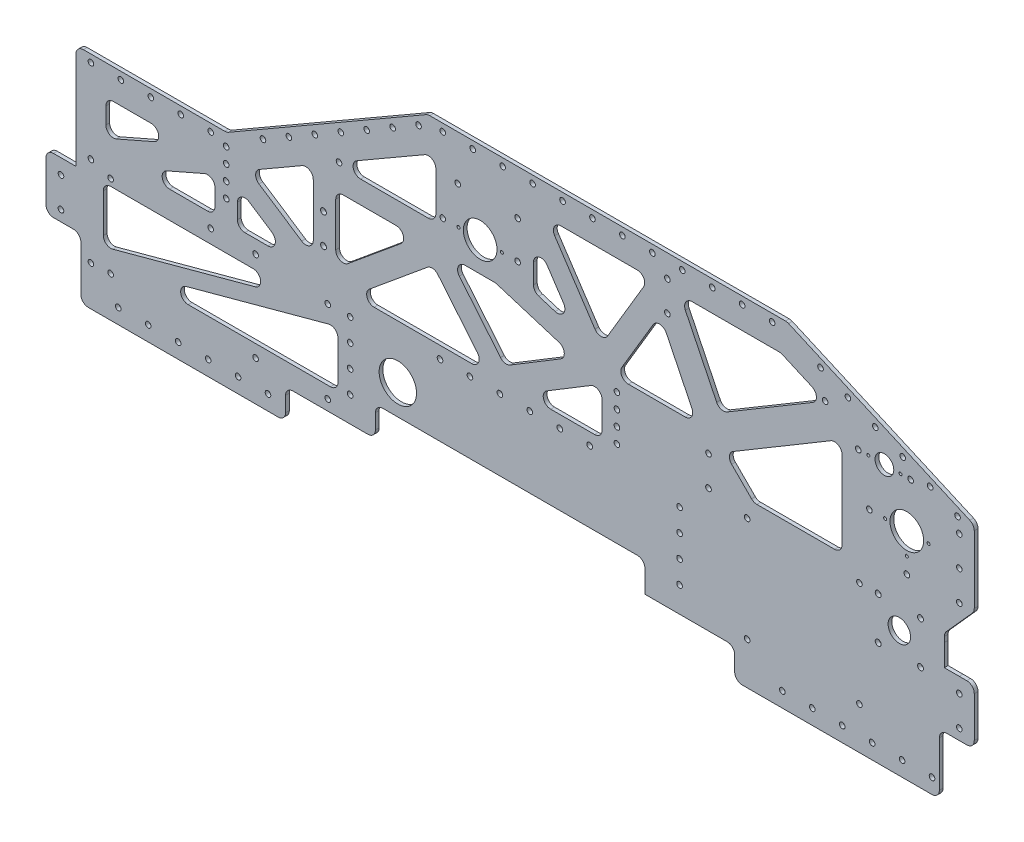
SolidWorks part; units mm, degrees
ref_plane "Front Plane" through (0, 0, 0) normal (0, 0, 1) x (1, 0, 0)
ref_plane "Top Plane" through (0, 0, 0) normal (0, 1, 0) x (1, 0, 0)
ref_plane "Right Plane" through (0, 0, 0) normal (1, 0, 0) x (0, 0, -1)
sketch "Sketch1" plane through (0, 0, 0) normal (0, 0, 1) x (1, 0, 0)
  line L0 (787.4, -148.803) -> (787.4, -101.6)
  line L1 (628.65, 85.725) -> (323.85, 85.725)
  line L2 (787.4, 15.875) -> (628.65, 85.725)
  line L3 (787.4, -101.6) -> (762, -101.6)
  line L4 (762, -101.6) -> (762, -76.2)
  line L5 (787.4, 15.875) -> (787.4, -73.025)
  line L6 (0, -101.6) -> (0, -148.803)
  line L7 (762, -76.2) -> (784.225, -76.2)
  line L8 (787.4, -148.803) -> (757.8269, -200.025)
  line L9 (29.5731, -200.025) -> (203.2, -200.025)
  line L10 (25.4, -76.2) -> (0, -76.2)
  line L11 (25.4, -101.6) -> (25.4, -76.2)
  line L12 (0, -148.803) -> (29.5731, -200.025)
  line L14 (757.8269, -200.025) -> (584.2, -200.025)
  line L16 (584.2, -200.025) -> (584.2, -174.625)
  line L17 (279.4, -149.225) -> (508, -149.225)
  line L19 (203.2, -174.625) -> (203.2, -200.025)
  line L20 (203.2, -174.625) -> (279.4, -174.625)
  line L22 (584.2, -174.625) -> (508, -174.625)
  line L23 (279.4, -149.225) -> (279.4, -174.625)
  line L24 (508, -174.625) -> (508, -149.225)
  line L25 (0, -101.6) -> (25.4, -101.6)
  line L26 (0, 0) -> (323.85, 85.725)
  line L27 (0, -76.2) -> (0, 0)
  arc A0 (787.4, -73.025) -> (784.225, -76.2) centre (784.225, -73.025) cw
  point P15 (787.4, -101.6)
  point P33 (29.5731, -200.025)
  point P36 (0, -148.803)
  point P39 (787.4, -148.803)
  point P42 (757.8269, -200.025)
  point P45 (584.2, -200.025)
  point P48 (508, -149.225)
  point P51 (279.4, -149.225)
  point P54 (203.2, -200.025)
  point P57 (0, -101.6)
  dimension "D9" = 3.175
  dimension "D26" = 285.75
  dimension "D4" = 25.4
  dimension "D5" = 150
  dimension "D7" = 25.4
  dimension "D8" = 150
  dimension "D10" = 158.75
  dimension "D12" = 98.425
  dimension "D14" = 25.4
  dimension "D15" = 25.4
  dimension "D16" = 59.1461
  dimension "D17" = 728.2539
  dimension "D20" = 76.2
  dimension "D21" = 173.6269
  dimension "D22" = 200.025
  dimension "D23" = 203.2
  dimension "D24" = 50.8
  dimension "D25" = 381
  dimension "D27" = 304.8
  dimension "D28" = 215.9
  dimension "D30" = 177.8
base flange "Base-Flange1" sketch "Sketch1" thickness 3.175 reverse thickness direction no parameters "D1"=7
sketch "Sketch98" plane through (0, 0, 0) normal (0, 0, 1) x (1, 0, 0)
  line L0 (787.4, -73.025) -> (787.4, 15.875) construction
  line L1 (730.1992, -17.145) -> (723.8492, -93.345) construction
  line L2 (730.1992, -17.145) -> (748.6269, -17.145) construction
  line L3 (730.1992, -17.145) -> (711.7715, -17.145) construction
  line L4 (730.1992, -17.145) -> (730.1992, -35.5727) construction
  line L5 (730.1992, -35.5727) -> (730.1992, -48.895) construction
  line L6 (711.7715, -17.145) -> (698.4492, -17.145) construction
  line L8 (741.8097, -111.3055) -> (705.8887, -111.3055) construction
  line L9 (741.8097, -111.3055) -> (741.8097, -75.3845) construction
  line L10 (741.8097, -75.3845) -> (705.8887, -75.3845) construction
  line L11 (705.8887, -111.3055) -> (705.8887, -75.3845) construction
  line L12 (741.8097, -111.3055) -> (705.8887, -75.3845) construction
  line L13 (741.8097, -75.3845) -> (705.8887, -111.3055) construction
  line L14 (584.2, -200.025) -> (757.8269, -200.025) construction
  circle A0 centre (730.1992, -17.145) radius 14.2875
  circle A1 centre (711.7715, -17.145) radius 1.27
  circle A2 centre (748.6269, -17.145) radius 1.27
  circle A3 centre (730.1992, -35.5727) radius 1.27
  circle A4 centre (698.4492, -17.145) radius 2.3812
  circle A5 centre (730.1992, -48.895) radius 2.3812
  circle A6 centre (730.1992, -17.145) radius 27.94 construction
  circle A8 centre (723.8492, -93.345) radius 9.525
  circle A9 centre (705.8887, -75.3845) radius 2.4892
  circle A10 centre (705.8887, -111.3055) radius 2.4892
  circle A11 centre (741.8097, -111.3055) radius 2.4892
  circle A12 centre (741.8097, -75.3845) radius 2.4892
  dimension "D1" = 28.575
  dimension "D6" = 2.54
  dimension "D7" = 4.7625
  dimension "D8" = 55.88
  dimension "D9" = 6.35
  dimension "D10" = 4.9784
  dimension "D12" = 19.05
  dimension "D2" = 57.2008
  dimension "D3" = 182.88
  dimension "D4" = 18.4277
  dimension "D5" = 31.75
  dimension "D11" = 50.8
  dimension "D13" = 76.2
extrude "Intakehole" cut sketch "Sketch98" against normal blind 19.05
sketch "Sketch104" plane through (0, 0, 0) normal (0, 0, 1) x (1, 0, 0)
  line L0 (605.79, -36.195) -> (624.2177, -36.195) construction
  line L1 (605.79, -36.195) -> (587.3623, -36.195) construction
  line L2 (787.4, -73.025) -> (787.4, 15.875) construction
  line L3 (688.975, 22.225) -> (697.5348, 22.225) construction
  line L4 (587.3623, -36.195) -> (574.04, -36.195) construction
  line L5 (624.2177, -36.195) -> (637.54, -36.195) construction
  line L6 (368.3, 15.875) -> (386.7277, 15.875) construction
  line L7 (386.7277, 15.875) -> (400.05, 15.875) construction
  line L8 (368.3, 15.875) -> (349.8723, 15.875) construction
  line L9 (349.8723, 15.875) -> (336.55, 15.875) construction
  line L10 (279.4, -149.225) -> (508, -149.225) construction
  line L12 (697.5348, 22.225) -> (711.2, 22.225) construction
  line L13 (724.8652, 22.225) -> (733.425, 22.225) construction
  line L14 (711.2, 22.225) -> (724.8652, 22.225) construction
  line L15 (628.65, 85.725) -> (323.85, 85.725) construction
  line L16 (584.2, -200.025) -> (757.8269, -200.025) construction
  circle A0 centre (605.79, -36.195) radius 14.2875 construction
  circle A1 centre (587.3623, -36.195) radius 1.27 construction
  circle A2 centre (624.2177, -36.195) radius 1.27 construction
  circle A3 centre (368.3, 15.875) radius 14.2875
  circle A4 centre (386.7277, 15.875) radius 1.27
  circle A5 centre (349.8723, 15.875) radius 1.27
  circle A6 centre (400.05, 15.875) radius 2.3813
  circle A7 centre (336.55, 15.875) radius 2.3813
  circle A8 centre (637.54, -36.195) radius 2.3812 construction
  circle A9 centre (574.04, -36.195) radius 2.3812 construction
  circle A10 centre (711.2, 22.225) radius 7.9375
  circle A11 centre (697.5348, 22.225) radius 1.27
  circle A12 centre (724.8652, 22.225) radius 1.27
  circle A13 centre (733.425, 22.225) radius 2.3812
  circle A14 centre (688.975, 22.225) radius 2.3812
  circle A15 centre (711.2, 22.225) radius 11.1125 construction
  circle A16 centre (724.8652, 22.225) radius 2.5527 construction
  dimension "D3" = 28.575
  dimension "D6" = 2.54
  dimension "D7" = 4.7625
  dimension "D12" = 15.875
  dimension "D14" = 5.1054
  dimension "D15" = 22.225
  dimension "D1" = 181.61
  dimension "D2" = 163.83
  dimension "D4" = 419.1
  dimension "D5" = 165.1
  dimension "D8" = 18.4277
  dimension "D9" = 31.75
  dimension "D10" = 76.2
  dimension "D11" = 63.5
  dimension "D13" = 22.225
extrude "PlateBearingHoles" cut sketch "Sketch104" against normal through all
sketch "Sketch107" plane through (0, 0, 0) normal (0, 0, 1) x (1, 0, 0)
  line L0 (0, 0) -> (0, -76.2) construction
  line L1 (0, -76.2) -> (25.4, -76.2) construction
  circle A0 centre (152.8481, -48.7743) radius 2.3813
  circle A1 centre (152.8481, -48.7743) radius 2.3813 construction
  circle A2 centre (152.8481, -61.4743) radius 2.3813
  circle A3 centre (152.8481, -61.4743) radius 2.3813 construction
  circle A4 centre (152.8481, -23.3743) radius 2.3813
  circle A6 centre (152.8481, -36.0743) radius 2.3813
  circle A8 centre (152.8481, -36.0743) radius 2.3813 construction
  circle A9 centre (152.8481, -23.3743) radius 2.3813 construction
  circle A10 centre (235.3981, -29.7243) radius 2.4892
  circle A11 centre (235.3981, -55.1243) radius 2.4892
  circle A12 centre (235.3981, -55.1243) radius 2.4892 construction
  circle A13 centre (235.3981, -29.7243) radius 2.4892 construction
  dimension "D1" = 25.4
  dimension "D2" = 6.35
  dimension "D3" = 82.55
  dimension "D4" = 12.7
  dimension "D5" = 12.7
  dimension "D6" = 12.7
  dimension "D7" = 152.8481
  dimension "D8" = 52.8257
extrude "Cut-Extrude23" cut sketch "Sketch107" against normal blind 3.175
sketch "Sketch108" plane through (0, 0, 0) normal (0, 0, 1) x (1, 0, 0)
  line L0 (584.2, -200.025) -> (757.8269, -200.025) construction
  line L1 (-9.937, -148.803) -> (29.5731, -148.803)
  line L2 (29.5731, -148.803) -> (29.5731, -225.003)
  line L3 (29.5731, -225.003) -> (-9.937, -225.003)
  line L4 (-9.937, -148.803) -> (-9.937, -225.003)
  line L5 (757.8269, -148.803) -> (757.8269, -214.0682)
  line L7 (852.5414, -214.0682) -> (757.8269, -214.0682)
  line L8 (852.5414, -214.0682) -> (852.5414, -148.803)
  line L9 (757.8269, -148.803) -> (852.5414, -148.803)
  line L12 (762, -88.9) -> (762, -76.2)
  line L13 (762, -101.6) -> (762, -76.2) construction
  line L14 (762, -76.2) -> (787.4, -47.8019)
  line L15 (787.4, -73.025) -> (787.4, 15.875) construction
  line L16 (787.4, -47.8019) -> (787.4, -88.9)
  line L17 (787.4, -88.9) -> (762, -88.9)
  line L18 (25.4, -88.9) -> (25.4, -76.2)
  line L19 (25.4, -76.2) -> (25.4, -101.6) construction
  line L20 (25.4, -76.2) -> (0, -47.8019)
  line L21 (0, 0) -> (0, -76.2) construction
  line L22 (0, -47.8019) -> (0, -88.9)
  line L23 (0, -88.9) -> (25.4, -88.9)
  dimension "D1" = 38.1
  dimension "D2" = 76.2
extrude "Cut-Extrude27" cut sketch "Sketch108" against normal blind 2.54
fillet "Fillet2" radius 6.35 7 edges at (0, 0, -1.5875) (29.5731, -148.803, -1.5875) (757.8269, -148.803, -1.5875) (762, -76.2, -1.5875) (787.4, -47.8019, -1.5875) (25.4, -76.2, -1.5875) (0, -47.8019, -1.5875)
sketch "Sketch109" plane through (0, 0, -3.175) normal (0, 0, -1) x (-1, 0, 0)
  line L0 (-25.4, -78.6255) -> (-25.4, -101.6) construction
  line L1 (-25.4, -89.8994) -> (28.273, -89.8994)
  line L2 (-25.4, -89.8994) -> (-25.4, 36.3327)
  line L3 (-25.4, 36.3327) -> (28.273, 36.3327)
  line L4 (28.273, -89.8994) -> (28.273, 36.3327)
  line L5 (-323.85, 85.725) -> (-25.4, 6.7235)
  line L6 (-323.85, 85.725) -> (-4.7251, 1.2508) construction
  line L7 (-323.85, 85.725) -> (-153.3729, -12.7)
  line L8 (-153.3729, -12.7) -> (-25.4, -12.7)
  line L9 (-25.4, -101.6) -> (0, -101.6) construction
  line L10 (-628.65, 85.725) -> (-323.85, 85.725) construction
  dimension "D1" = 88.9
  dimension "D2" = 150
extrude "Cuts" cut sketch "Sketch109" against normal through all
sketch "Sketch110" plane through (0, 0, -3.175) normal (0, 0, -1) x (-1, 0, 0)
  line L0 (-787.4, -45.3765) -> (-787.4, 15.875) construction
  line L3 (-574.6608, -82.423) -> (-473.0608, -82.423) construction
  line L4 (-574.6608, -82.423) -> (-574.6608, -31.623) construction
  line L5 (-574.6608, -31.623) -> (-473.0608, -31.623) construction
  line L6 (-473.0608, -82.423) -> (-473.0608, -31.623) construction
  circle A0 centre (-484.3028, -76.073) radius 2.3812
  circle A1 centre (-484.3028, -63.373) radius 2.3812
  circle A2 centre (-484.3028, -50.673) radius 2.3812
  circle A3 centre (-484.3028, -37.973) radius 2.3812
  circle A4 centre (-549.2608, -57.023) radius 3.9687 construction
  circle A5 centre (-561.9608, -44.323) radius 2.3812
  circle A6 centre (-561.9608, -69.723) radius 2.3812
  circle A7 centre (-730.1992, -17.145) radius 14.2875 construction
  dimension "D1" = 4.7625
  dimension "D5" = 7.9375
  dimension "D2" = 12.7
  dimension "D3" = 12.7
  dimension "D4" = 12.7
  dimension "D6" = 238.1392
  dimension "D7" = 39.878
  dimension "D8" = 11.242
  dimension "D9" = 6.35
  dimension "D10" = 101.6
  dimension "D11" = 50.8
  dimension "D12" = 25.4
  dimension "D13" = 25.4
  dimension "D14" = 12.7
  dimension "D15" = 12.7
  dimension "D16" = 12.7
extrude "Cut-Extrude29" cut sketch "Sketch110" against normal through all
sketch "Sketch111" plane through (0, 0, 0) normal (0, 0, 1) x (1, 0, 0)
  line L0 (29.5731, -200.025) -> (203.2, -200.025) construction
  line L1 (29.5731, -155.153) -> (29.5731, -200.025) construction
  line L2 (584.2, -174.625) -> (584.2, -200.025) construction
  line L3 (584.2, -200.025) -> (757.8269, -200.025) construction
  line L4 (25.4, -101.6) -> (0, -101.6) construction
  line L5 (0, -101.6) -> (0, -148.803) construction
  line L7 (787.4, -101.6) -> (762, -101.6) construction
  line L8 (787.4, -148.803) -> (787.4, -101.6) construction
  circle A0 centre (61.3231, -187.325) radius 2.3813
  circle A1 centre (86.7231, -187.325) radius 2.3812
  circle A2 centre (112.1231, -187.325) radius 2.3813
  circle A3 centre (137.5231, -187.325) radius 2.3813
  circle A4 centre (162.9231, -187.325) radius 2.3813
  circle A5 centre (188.3231, -187.325) radius 2.3812
  circle A6 centre (624.586, -187.325) radius 2.3812
  circle A7 centre (649.986, -187.325) radius 2.3812
  circle A8 centre (675.386, -187.325) radius 2.3812
  circle A9 centre (700.786, -187.325) radius 2.3812
  circle A10 centre (726.186, -187.325) radius 2.3812
  circle A11 centre (751.586, -187.325) radius 2.3812
  circle A12 centre (12.7, -114.3) radius 2.3812
  circle A13 centre (12.7, -139.7) radius 2.3812
  circle A14 centre (774.7, -114.3) radius 2.3812
  circle A15 centre (774.7, -139.7) radius 2.3812
  dimension "D1" = 4.7625
  dimension "D6" = 4.7625
  dimension "D11" = 4.7625
  dimension "D15" = 4.7625
  dimension "D2" = 12.7
  dimension "D3" = 31.75
  dimension "D5" = 25.4
  dimension "D7" = 40.386
  dimension "D8" = 12.7
  dimension "D10" = 25.4
  dimension "D12" = 12.7
  dimension "D13" = 12.7
  dimension "D14" = 25.4
  dimension "D16" = 12.7
  dimension "D17" = 12.7
  dimension "D18" = 25.4
  dimension "D4" = 6
  dimension "D9" = 6
extrude "Cut-Extrude30" cut sketch "Sketch111" against normal blind 3.175
sketch "Sketch113" plane through (0, 0, -3.175) normal (0, 0, -1) x (-1, 0, 0)
  circle A0 centre (-258.019, -153.02) radius 2.3813 construction
  circle A1 centre (-258.019, -133.97) radius 2.3813 construction
  circle A2 centre (-258.019, -114.92) radius 2.3813 construction
  circle A3 centre (-258.019, -95.87) radius 2.3812 construction
  circle A4 centre (-537.419, -95.87) radius 2.3813 construction
  circle A5 centre (-537.419, -114.92) radius 2.3813 construction
  circle A6 centre (-537.419, -133.97) radius 2.3813 construction
  circle A7 centre (-537.419, -153.02) radius 2.3813 construction
  circle A8 centre (-258.019, -153.02) radius 2.3813
  circle A9 centre (-258.019, -133.97) radius 2.3813
  circle A10 centre (-258.019, -114.92) radius 2.3813
  circle A11 centre (-258.019, -95.87) radius 2.3812
  circle A12 centre (-537.419, -95.87) radius 2.3812
  circle A13 centre (-537.419, -114.92) radius 2.3812
  circle A14 centre (-537.419, -133.97) radius 2.3812
  circle A15 centre (-537.419, -153.02) radius 2.3812
extrude "Cut-Extrude31" cut sketch "Sketch113" against normal through all
sketch "Sketch114" plane through (0, 0, 0) normal (0, 0, 1) x (1, 0, 0)
  line L0 (279.4, -149.225) -> (508, -149.225) construction
  line L1 (279.4, -107.0245) -> (315.2505, -107.0245) construction
  line L2 (279.4, -107.0245) -> (279.4, -142.875) construction
  line L3 (279.4, -142.875) -> (315.2505, -142.875) construction
  line L4 (315.2505, -107.0245) -> (315.2505, -142.875) construction
  line L5 (279.4, -174.625) -> (279.4, -149.225) construction
  line L6 (279.4, -174.625) -> (279.4, -149.225) construction
  circle A0 centre (298.45, -123.825) radius 25.4 construction
  circle A1 centre (298.45, -123.825) radius 15.875
  circle A2 centre (279.4, -107.0245) radius 2.4892 construction
  circle A3 centre (315.2505, -107.0245) radius 2.4892 construction
  circle A4 centre (315.2505, -142.875) radius 2.4892 construction
  circle A5 centre (279.4, -142.875) radius 2.4892 construction
  dimension "D1" = 50.8
  dimension "D2" = 31.75
  dimension "D3" = 4.9784
  dimension "D4" = 25.4
  dimension "D5" = 19.05
extrude "VersaplanetaryMount" cut sketch "Sketch114" against normal through all
fillet "Fillet3" radius 6.35 20 edges at (762, -101.6, -1.5875) (787.4, -101.6, -1.5875) (787.4, -148.803, -1.5875) (757.8269, -200.025, -1.5875) (584.2, -200.025, -1.5875) (203.2, -200.025, -1.5875) (29.5731, -200.025, -1.5875) (0, -148.803, -1.5875) (0, -101.6, -1.5875) (25.4, -101.6, -1.5875) (787.4, 15.875, -1.5875) (628.65, 85.725, -1.5875) (584.2, -174.625, -1.5875) (508, -149.225, -1.5875) (279.4, -149.225, -1.5875) (279.4, -174.625, -1.5875) (203.2, -174.625, -1.5875) (323.85, 85.725, -1.5875) (153.3729, -12.7, -1.5875) (25.4, -12.7, -1.5875)
sketch "Sketch115" plane through (0, 0, 0) normal (0, 0, 1) x (1, 0, 0)
  line L0 (25.4, -89.8994) -> (25.4, -95.25) construction
  line L2 (23.2231, -148.803) -> (6.35, -148.803) construction
  circle A0 centre (38.1, -90.0099) radius 2.3812
  circle A1 centre (139.7, -90.0099) radius 2.3813
  circle A2 centre (177.8, -90.0099) radius 2.3813
  circle A3 centre (177.8, -166.2099) radius 2.3813
  circle A4 centre (38.1, -166.2099) radius 2.3812
  dimension "D2" = 4.7625
  dimension "D5" = 17.4069
  dimension "D1" = 12.7
  dimension "D3" = 101.6
  dimension "D4" = 139.7
  dimension "D6" = 76.2
extrude "Cut-Extrude32" cut sketch "Sketch115" against normal blind 3.175
sketch "Sketch116" plane through (0, 0, -3.175) normal (0, 0, -1) x (-1, 0, 0)
  line L0 (-385.019, -88.885) -> (-410.419, -88.885) construction
  line L1 (-485.984, -90.17) -> (-423.754, -90.17) construction
  line L2 (-485.984, -90.17) -> (-485.984, -132.08) construction
  line L3 (-485.984, -132.08) -> (-423.754, -132.08) construction
  line L4 (-423.754, -90.17) -> (-423.754, -132.08) construction
  line L5 (-485.984, -90.17) -> (-423.754, -132.08) construction
  line L6 (-485.984, -132.08) -> (-423.754, -90.17) construction
  line L7 (-393.909, -90.17) -> (-331.679, -90.17) construction
  line L8 (-393.909, -90.17) -> (-393.909, -132.08) construction
  line L9 (-393.909, -132.08) -> (-331.679, -132.08) construction
  line L10 (-331.679, -90.17) -> (-331.679, -132.08) construction
  line L11 (-393.909, -90.17) -> (-331.679, -132.08) construction
  line L12 (-393.909, -132.08) -> (-331.679, -90.17) construction
  line L13 (-397.719, -88.885) -> (-397.719, -149.225) construction
  line L18 (-285.75, -149.225) -> (-501.65, -149.225) construction
  circle A0 centre (-334.219, -88.885) radius 2.3813
  circle A1 centre (-258.019, -95.87) radius 2.3812 construction
  circle A2 centre (-359.619, -88.885) radius 2.3813
  circle A3 centre (-385.019, -88.885) radius 2.3813
  circle A4 centre (-410.419, -88.885) radius 2.3813
  circle A5 centre (-435.819, -88.885) radius 2.3813
  circle A6 centre (-461.219, -88.885) radius 2.3813
  point P5 (-454.869, -111.125)
  point P19 (-362.794, -111.125)
  dimension "D3" = 4.7625
  dimension "D1" = 76.2
  dimension "D2" = 6.985
  dimension "D5" = 25.4
  dimension "D6" = 62.23
  dimension "D7" = 41.91
  dimension "D8" = 57.15
  dimension "D9" = 38.1
  dimension "D11" = 34.925
  dimension "D4" = 6
extrude "Cut-Extrude33" cut sketch "Sketch116" against normal blind 3.175
sketch "Sketch118" plane through (0, 0, -3.175) normal (0, 0, -1) x (-1, 0, 0)
  line L1 (-690.0137, -75.3845) -> (-594.7637, -75.3845) construction
  line L2 (-690.0137, -75.3845) -> (-690.0137, -164.2845) construction
  line L3 (-690.0137, -164.2845) -> (-594.7637, -164.2845) construction
  line L4 (-594.7637, -75.3845) -> (-594.7637, -164.2845) construction
  line L5 (-690.0137, -75.3845) -> (-594.7637, -164.2845) construction
  line L6 (-690.0137, -164.2845) -> (-594.7637, -75.3845) construction
  circle A0 centre (-690.0137, -75.3845) radius 2.3812
  circle A1 centre (-594.7637, -75.3845) radius 2.3812
  circle A2 centre (-594.7637, -164.2845) radius 2.3812
  circle A3 centre (-690.0137, -164.2845) radius 2.3812
  point P0 (-642.3887, -119.8345)
  point P5 (-705.8887, -75.3845)
  dimension "D4" = 4.7625
  dimension "D1" = 88.9
  dimension "D2" = 95.25
  dimension "D3" = 63.5
extrude "Cut-Extrude35" cut sketch "Sketch118" against normal blind 3.175
sketch "Sketch120" plane through (0, 0, -3.175) normal (0, 0, -1) x (-1, 0, 0)
  line L1 (-238.969, -95.87) -> (-54.819, -95.87) construction
  line L2 (-238.969, -95.87) -> (-238.969, -165.72) construction
  line L3 (-238.969, -165.72) -> (-54.819, -165.72) construction
  line L4 (-54.819, -95.87) -> (-54.819, -165.72) construction
  circle A0 centre (-238.969, -95.87) radius 2.3813
  circle A1 centre (-238.969, -165.72) radius 2.3813
  circle A2 centre (-54.819, -165.72) radius 2.3812
  circle A3 centre (-54.819, -95.87) radius 2.3812
  point P8 (-258.019, -95.87)
  dimension "D3" = 4.7625
  dimension "D1" = 69.85
  dimension "D2" = 184.15
  dimension "D4" = 19.05
extrude "Cut-Extrude36" cut sketch "Sketch120" against normal blind 3.175
sketch "Sketch126" plane through (0, 0, -3.175) normal (0, 0, -1) x (-1, 0, 0)
  line L1 (-783.6074, 17.5437) -> (-629.8722, 85.1873) construction
  line L2 (-775.7755, 20.9898) -> (-787.4, 15.875) construction
  line L3 (-787.4, 11.7315) -> (-787.4, 15.875) construction
  line L4 (-773.2181, 15.1775) -> (-775.7755, 20.9898) construction
  line L5 (-627.3148, 85.725) -> (-325.5515, 85.725) construction
  line L6 (-615.95, 85.725) -> (-628.65, 85.725) construction
  line L7 (-633.2345, 83.7078) -> (-628.65, 85.725) construction
  line L8 (-325.5515, 85.725) -> (-323.85, 85.725) construction
  line L9 (-312.8515, 79.375) -> (-323.85, 85.725) construction
  line L10 (-322.3765, 84.8743) -> (-154.8464, -11.8493) construction
  line L11 (-312.8515, 79.375) -> (-316.0265, 73.8757) construction
  line L12 (-25.4, -19.05) -> (-25.4, -12.7) construction
  line L13 (-25.4, -12.7) -> (-38.1, -12.7) construction
  line L14 (-151.6714, -12.7) -> (-31.75, -12.7) construction
  circle A0 centre (-773.2181, 15.1775) radius 2.3812
  circle A1 centre (-749.9691, 25.4071) radius 2.3812
  circle A2 centre (-726.7201, 35.6367) radius 2.3812
  circle A3 centre (-703.4711, 45.8662) radius 2.3812
  circle A4 centre (-680.2221, 56.0958) radius 2.3812
  circle A5 centre (-656.9731, 66.3253) radius 2.3812
  circle A6 centre (-615.95, 79.375) radius 2.3812
  circle A8 centre (-590.55, 79.375) radius 2.3812
  circle A9 centre (-565.15, 79.375) radius 2.3812
  circle A10 centre (-539.75, 79.375) radius 2.3812
  circle A11 centre (-514.35, 79.375) radius 2.3812
  circle A12 centre (-488.95, 79.375) radius 2.3812
  circle A13 centre (-463.55, 79.375) radius 2.3812
  circle A14 centre (-438.15, 79.375) radius 2.3812
  circle A15 centre (-412.75, 79.375) radius 2.3812
  circle A16 centre (-387.35, 79.375) radius 2.3812
  circle A17 centre (-361.95, 79.375) radius 2.3812
  circle A18 centre (-336.55, 79.375) radius 2.3812
  circle A19 centre (-316.0265, 73.8757) radius 2.3813
  arc A20 (-322.3765, 84.8743) -> (-325.5515, 85.725) centre (-325.5515, 79.375) ccw construction
  circle A21 centre (-294.0294, 61.1757) radius 2.3813
  circle A22 centre (-272.0324, 48.4757) radius 2.3813
  circle A23 centre (-250.0353, 35.7757) radius 2.3813
  circle A24 centre (-228.0383, 23.0757) radius 2.3813
  circle A25 centre (-206.0413, 10.3757) radius 2.3813
  circle A26 centre (-184.0442, -2.3243) radius 2.3813
  circle A27 centre (-38.1, -19.05) radius 2.3812
  circle A28 centre (-63.5, -19.05) radius 2.3813
  circle A29 centre (-88.9, -19.05) radius 2.3812
  circle A30 centre (-114.3, -19.05) radius 2.3813
  circle A31 centre (-139.7, -19.05) radius 2.3813
  dimension "D2" = 4.7625
  dimension "D1" = 6.35
  dimension "D3" = 12.7
  dimension "D5" = 6.35
  dimension "D6" = 12.7
  dimension "D8" = 12.7
  dimension "D9" = 6.35
  dimension "D11" = 6.35
  dimension "D12" = 12.7
  dimension "D4" = 6
  dimension "D7" = 12
  dimension "D10" = 7
  dimension "D13" = 5
extrude "Cut-Extrude38" cut sketch "Sketch126" against normal blind 3.175
sketch "Sketch131" plane through (0, 0, -3.175) normal (0, 0, -1) x (-1, 0, 0)
  line L0 (-410.667, -18.3632) -> (-468.8619, -36.4096) construction
  line L1 (-226.7095, -78.6255) -> (-226.7095, 9.7844)
  line L2 (-226.7095, 9.7844) -> (-413.4882, 9.7844)
  line L3 (-330.6559, 60.325) -> (-330.6559, 9.7844)
  line L4 (-226.7095, -78.6255) -> (-162.3731, -78.6255)
  line L5 (-162.3731, -78.6255) -> (-162.3731, -36.2421)
  line L6 (-226.7095, -78.6255) -> (-162.3731, -36.2421)
  line L7 (-143.3231, -78.6255) -> (-143.3231, -38.1)
  line L8 (-143.3231, -78.6255) -> (-50.8, -78.6255)
  line L9 (-143.3231, -38.1) -> (-50.8, -78.6255)
  line L10 (-221.4695, -86.5796) -> (-157.1331, -44.1962)
  line L11 (-147.1446, -46.8248) -> (-54.6215, -87.3503)
  line L12 (-231.9495, -70.6714) -> (-167.6131, -28.2879)
  line L13 (-139.5017, -29.3752) -> (-46.9785, -69.9007)
  line L14 (-560.0294, -16.4016) -> (-668.757, 48.3781)
  line L15 (-573.0302, -38.2223) -> (-681.7577, 26.5574)
  line L16 (-535.1628, 65.8961) -> (-577.9426, -21.7408)
  line L17 (-512.3371, 54.7539) -> (-555.117, -32.8831)
  line L52 (-675.2573, 37.4678) -> (-675.2573, -61.1316)
  line L53 (-675.2573, -61.1316) -> (-600.3494, -61.1316)
  line L54 (-600.3494, -61.1316) -> (-566.5298, -27.312)
  line L55 (-566.5298, -27.312) -> (-471.6831, -27.312)
  line L56 (-471.6831, -27.312) -> (-471.6831, -78.6255)
  line L57 (-471.6831, -78.6255) -> (-245.7595, -78.6255)
  line L58 (-245.7595, -78.6255) -> (-245.7595, -9.2656)
  line L59 (-245.7595, -9.2656) -> (-413.4882, -9.2656)
  line L60 (-413.4882, -9.2656) -> (-413.4882, 60.325)
  line L61 (-413.4882, -9.2656) -> (-471.6831, -27.312)
  line L62 (-245.7595, -78.6255) -> (-329.6239, -9.2656)
  line L63 (-329.6239, -9.2656) -> (-386.9878, -78.6255)
  line L64 (-386.9878, -78.6255) -> (-471.6831, -27.312)
  line L65 (-471.6831, -27.312) -> (-413.4882, 60.325)
  line L66 (-471.6831, -27.312) -> (-523.7499, 60.325)
  line L67 (-523.7499, 60.325) -> (-566.5298, -27.312)
  line L68 (-566.5298, -27.312) -> (-675.2573, 37.4678)
  line L69 (-463.4943, -22.4468) -> (-524.5713, 80.3556)
  line L72 (-463.7482, -32.5811) -> (-405.5533, 55.0559)
  line L73 (-412.1284, 1.1285) -> (-474.5043, -18.2143)
  line L74 (-239.689, -71.2855) -> (-330.8933, 4.1448)
  line L75 (-330.8933, 4.1448) -> (-389.0862, -66.2174)
  line L76 (-389.0862, -66.2174) -> (-466.7475, -19.1655)
  line L77 (-479.8719, -32.1771) -> (-522.9286, 40.2944)
  line L78 (-167.5464, -33.8463) -> (-330.6559, 60.325)
  line L79 (-330.6559, 60.325) -> (-623.3091, 60.325)
  line L80 (-623.3091, 60.325) -> (-762, -0.699)
  line L81 (-762, -0.699) -> (-762, -38.1)
  line L82 (-762, -38.1) -> (-744.6849, -57.4588)
  line L83 (-736.6, -78.6255) -> (-736.6, -95.25)
  line L84 (-732.4269, -155.153) -> (-732.4269, -174.625)
  line L85 (-732.4269, -174.625) -> (-608.9585, -174.625)
  line L86 (-577.85, -149.225) -> (-532.7585, -149.225)
  line L87 (-501.65, -123.825) -> (-285.75, -123.825)
  line L88 (-254.6415, -149.225) -> (-209.55, -149.225)
  line L89 (-178.4415, -174.625) -> (-54.9731, -174.625)
  line L90 (-54.9731, -174.625) -> (-54.9731, -155.153)
  line L91 (-50.8, -95.25) -> (-50.8, -89.8994)
  line L92 (-50.8, -89.8994) -> (-50.8, -38.1)
  line L93 (-50.8, -38.1) -> (-151.6714, -38.1)
  line L94 (-167.5464, -33.8463) -> (-330.6559, 60.325)
  line L95 (-330.6559, 60.325) -> (-623.3091, 60.325)
  line L96 (-623.3091, 60.325) -> (-762, -0.699)
  line L97 (-762, -0.699) -> (-762, -38.1)
  line L98 (-762, -38.1) -> (-744.6849, -57.4588)
  line L99 (-736.6, -78.6255) -> (-736.6, -95.25)
  line L100 (-732.4269, -155.153) -> (-732.4269, -174.625)
  line L101 (-732.4269, -174.625) -> (-608.9585, -174.625)
  line L102 (-577.85, -149.225) -> (-532.7585, -149.225)
  line L103 (-501.65, -123.825) -> (-285.75, -123.825)
  line L104 (-254.6415, -149.225) -> (-209.55, -149.225)
  line L105 (-178.4415, -174.625) -> (-54.9731, -174.625)
  line L106 (-54.9731, -174.625) -> (-54.9731, -155.153)
  line L107 (-50.8, -95.25) -> (-50.8, -89.8994)
  line L108 (-50.8, -89.8994) -> (-50.8, -38.1)
  line L109 (-50.8, -38.1) -> (-151.6714, -38.1)
  line L112 (-479.618, -22.0428) -> (-421.423, 65.5941)
  line L113 (-381.3294, -9.2656) -> (-468.8619, -36.4096)
  line L114 (-251.83, -85.9654) -> (-328.3544, -22.6761)
  line L115 (-328.3544, -22.6761) -> (-384.8894, -91.0336)
  line L116 (-384.8894, -91.0336) -> (-476.6187, -35.4584)
  line L117 (-416.3094, -0.168) -> (-474.5043, -18.2143) construction
  line L118 (-570.5481, -13.8304) -> (-670.3821, 45.6505) construction
  line L119 (-562.5115, -40.7935) -> (-680.1326, 29.285) construction
  line L120 (-522.9286, 40.2944) -> (-562.5115, -40.7935) construction
  line L121 (-524.5713, 80.3556) -> (-570.5481, -13.8304) construction
  circle A0 centre (-152.8481, -48.7743) radius 2.3813 construction
  arc A72 (-736.6, -78.6255) -> (-744.6849, -57.4588) centre (-768.35, -78.6255) ccw
  arc A73 (-755.9628, -124.4839) -> (-736.6, -95.25) centre (-768.35, -95.25) ccw
  arc A74 (-732.4269, -155.153) -> (-755.9628, -124.4839) centre (-764.1769, -155.153) ccw
  arc A75 (-577.85, -149.225) -> (-608.9585, -174.625) centre (-577.85, -180.975) ccw
  arc A76 (-501.65, -123.825) -> (-532.7585, -149.225) centre (-501.65, -155.575) ccw
  arc A77 (-254.6415, -149.225) -> (-285.75, -123.825) centre (-285.75, -155.575) ccw
  arc A78 (-178.4415, -174.625) -> (-209.55, -149.225) centre (-209.55, -180.975) ccw
  arc A79 (-31.4372, -124.4839) -> (-54.9731, -155.153) centre (-23.2231, -155.153) ccw
  arc A80 (-50.8, -95.25) -> (-31.4372, -124.4839) centre (-19.05, -95.25) ccw
  arc A81 (-167.5464, -33.8463) -> (-151.6714, -38.1) centre (-151.6714, -6.35) ccw
  arc A82 (-736.6, -78.6255) -> (-744.6849, -57.4588) centre (-768.35, -78.6255) ccw
  arc A83 (-755.9628, -124.4839) -> (-736.6, -95.25) centre (-768.35, -95.25) ccw
  arc A84 (-732.4269, -155.153) -> (-755.9628, -124.4839) centre (-764.1769, -155.153) ccw
  arc A85 (-577.85, -149.225) -> (-608.9585, -174.625) centre (-577.85, -180.975) ccw
  arc A86 (-501.65, -123.825) -> (-532.7585, -149.225) centre (-501.65, -155.575) ccw
  arc A87 (-254.6415, -149.225) -> (-285.75, -123.825) centre (-285.75, -155.575) ccw
  arc A88 (-178.4415, -174.625) -> (-209.55, -149.225) centre (-209.55, -180.975) ccw
  arc A89 (-31.4372, -124.4839) -> (-54.9731, -155.153) centre (-23.2231, -155.153) ccw
  arc A90 (-50.8, -95.25) -> (-31.4372, -124.4839) centre (-19.05, -95.25) ccw
  arc A91 (-167.5464, -33.8463) -> (-151.6714, -38.1) centre (-151.6714, -6.35) ccw
  dimension "D5" = 19.05
  dimension "D6" = 9.525
  dimension "D1" = 25.4
  dimension "D2" = 9.525
  dimension "D3" = 9.525
  dimension "D4" = 19.05
  dimension "D7" = 9.525
  dimension "D8" = 9.525
  dimension "D9" = 12.7
  dimension "D10" = 12.7
  dimension "D11" = 12.7
  dimension "D12" = 12.7
extrude "Cut-Extrude41" cut sketch "Sketch131" against normal blind 3.175
fillet "Fillet4" radius 6.35 45 edges at (314.6785, -9.2656, -1.5875) (245.7595, -9.2656, -1.5875) (245.7595, -66.265, -1.5875) (374.6273, -78.6255, -1.5875) (328.3544, -22.6761, -1.5875) (260.7049, -78.6255, -1.5875) (471.6831, -38.4487, -1.5875) (405.3696, -78.6255, -1.5875) (471.6831, -78.6255, -1.5875) (389.0862, -66.2174, -1.5875) (448.6371, -30.1378, -1.5875) (381.3294, -9.2656, -1.5875) (341.9844, -9.2656, -1.5875) (512.6707, 60.325, -1.5875) (424.922, 60.325, -1.5875) (471.2348, -9.4184, -1.5875) (482.7624, -27.312, -1.5875) (623.3091, 60.325, -1.5875) (675.2573, -61.1316, -1.5875) (600.3494, -61.1316, -1.5875) (448.9448, -10.2883, -1.5875) (413.4882, 43.1066, -1.5875) (413.4882, 0.7068, -1.5875) (74.5409, -78.6255, -1.5875) (143.3231, -78.6255, -1.5875) (143.3231, -48.4986, -1.5875) (330.6559, 9.7844, -1.5875) (330.6559, 60.325, -1.5875) (243.117, 9.7844, -1.5875) (226.7095, 0.3115, -1.5875) (172.0786, -31.2297, -1.5875) (226.7095, -67.2194, -1.5875) (162.3731, -47.6482, -1.5875) (162.3731, -78.6255, -1.5875) (209.3955, -78.6255, -1.5875) (119.5822, -38.1, -1.5875) (50.8, -38.1, -1.5875) (50.8, -68.2269, -1.5875) (675.2573, 22.6845, -1.5875) (575.7937, -36.5758, -1.5875) (660.985, 43.7476, -1.5875) (537.8823, 60.325, -1.5875) (520.9891, 37.0298, -1.5875) (552.3974, -27.312, -1.5875) (571.8875, -9.3366, -1.5875)
sketch "Sketch132" plane through (0, 0, -3.175) normal (0, 0, -1) x (-1, 0, 0)
  line L0 (-590.55, -200.025) -> (-751.4769, -200.025) construction
  line L1 (-787.4, -45.3765) -> (-787.4, 11.7315) construction
  line L2 (-627.3148, 85.725) -> (-325.5515, 85.725) construction
  line L3 (-656.9731, 66.3253) -> (-680.2221, 56.0958) construction
  line L4 (-668.5976, 61.2106) -> (-660.9254, 43.7738) construction
  line L5 (-228.0383, 23.0757) -> (-250.0353, 35.7757) construction
  line L6 (-239.0368, 29.4257) -> (-248.5618, 12.928) construction
  circle A0 centre (-774.7, 3.175) radius 2.3812
  circle A1 centre (-774.7, -22.225) radius 2.3812
  circle A2 centre (-774.7, -47.625) radius 2.3812
  circle A3 centre (-527.05, 66.675) radius 2.3812
  circle A4 centre (-514.35, 79.375) radius 2.3813 construction
  circle A5 centre (-527.05, 41.275) radius 2.3812
  circle A6 centre (-660.9254, 43.7738) radius 2.3812
  circle A7 centre (-400.05, 47.625) radius 2.3813
  circle A8 centre (-349.25, 47.625) radius 2.3813
  circle A9 centre (-387.35, 79.375) radius 2.3812 construction
  circle A10 centre (-248.5618, 12.928) radius 2.3813
  circle A11 centre (-361.95, 79.375) radius 2.3812 construction
  dimension "D1" = 4.7625
  dimension "D5" = 4.7625
  dimension "D7" = 12.7
  dimension "D9" = 4.7625
  dimension "D11" = 12.7
  dimension "D12" = 12.7
  dimension "D13" = 4.7625
  dimension "D14" = 38.1
  dimension "D6" = 12.7
  dimension "D16" = 4.7625
  dimension "D2" = 203.2
  dimension "D3" = 12.7
  dimension "D10" = 19.05
  dimension "D15" = 19.05
  dimension "D4" = 3
  dimension "D8" = 2
extrude "Cut-Extrude42" cut sketch "Sketch132" against normal through all
sketch "Sketch133" plane through (0, 0, -3.175) normal (0, 0, -1) x (-1, 0, 0)
  line L0 (-209.55, -174.625) -> (-273.05, -174.625) construction
  line L1 (-247.65, -101.6) -> (-48.6231, -101.6)
  line L2 (-247.65, -101.6) -> (-247.65, -155.575)
  line L3 (-247.65, -155.575) -> (-48.6231, -155.575)
  line L4 (-48.6231, -101.6) -> (-48.6231, -155.575)
  line L5 (-29.5731, -155.153) -> (-29.5731, -193.675) construction
  line L6 (-19.05, -101.6) -> (-6.35, -101.6) construction
  line L7 (-279.4, -168.275) -> (-279.4, -155.575) construction
  line L8 (-247.65, -101.6) -> (-48.6231, -155.575)
  line L9 (-249.3121, -107.7286) -> (-50.2851, -161.7036)
  line L10 (-245.9879, -95.4714) -> (-46.961, -149.4464)
  point P10 (-279.4, -161.925)
  dimension "D1" = 19.05
  dimension "D2" = 19.05
  dimension "D3" = 31.75
  dimension "D4" = 6.35
  dimension "D5" = 6.35
extrude "Cut-Extrude43" cut sketch "Sketch133" against normal through all contours L9 L2 L3 | L1 L10 L4
fillet "Fillet5" radius 6.35 6 edges at (48.6231, -101.6, -1.5875) (223.3893, -101.6, -1.5875) (72.8838, -155.575, -1.5875) (247.65, -155.575, -1.5875) (247.65, -108.1794, -1.5875) (48.6231, -148.9956, -1.5875)
sketch "Sketch134" plane through (0, 0, -3.175) normal (0, 0, -1) x (-1, 0, 0)
  line L0 (-25.4, -19.05) -> (-25.4, -89.8994) construction
  line L1 (-6.35, -101.6) -> (-25.4, -101.6)
  line L2 (-6.35, -101.6) -> (-6.35, -54.4747)
  line L3 (-6.35, -54.4747) -> (-25.4, -54.4747)
  line L4 (-25.4, -101.6) -> (-25.4, -54.4747)
  line L5 (-781.05, -101.6) -> (-768.35, -101.6) construction
  line L6 (-774.7, -101.6) -> (-762, -101.6)
  line L7 (-774.7, -101.6) -> (-774.7, -83.0523)
  line L8 (-774.7, -83.0523) -> (-762, -83.0523)
  line L9 (-762, -101.6) -> (-762, -83.0523)
  line L10 (-762, -95.25) -> (-762, -78.6255) construction
extrude "Cut-Extrude44" cut sketch "Sketch134" against normal through all
sketch "Bend-Lines1" [suppressed] plane through (0, 0, 0) normal (0, 1, 0) x (1, 0, 0)
sketch "Bounding-Box1" [suppressed] plane through (0, 0, 0) normal (0, 1, 0) x (1, 0, 0)
sheet metal parameters "Sheet-Metal2" thickness 3.175 parameters "D1"=7
flat pattern "Flat-Pattern2"
sketch "Bend-Lines2" plane through (0, 0, 0) normal (0, 1, 0) x (1, 0, 0)
sketch3d "Bounding-Box2" [suppressed]
  line L0 (-784.225, -127, 0) -> (3.175, -127, 0) construction
  line L1 (-784.225, 152.4, 0) -> (3.175, 152.4, 0) construction
  line L2 (-784.225, -127, 0) -> (-784.225, 152.4, 0) construction
  line L3 (3.175, -127, 0) -> (3.175, 152.4, 0) construction
sheet metal parameters "Sheet-Metal34" thickness 3.175 parameters "D1"=7
flat pattern "Flat-Pattern2"
sketch "Bend-Lines3" plane through (0, 0, 0) normal (0, 0, 1) x (1, 0, 0)
  line L0 (783.9696, -150.708) -> (783.9696, -117.7925) construction
  line L1 (3.4304, -117.7925) -> (3.4304, -150.708) construction
  line L2 (29.5731, -198.4996) -> (203.2, -198.4996) construction
  line L3 (584.2, -198.4996) -> (757.8269, -198.4996) construction
  line L4 (508, -173.0996) -> (558.8, -173.0996) construction
  line L5 (228.6, -173.0996) -> (279.4, -173.0996) construction
  line L6 (28.8304, -90.805) -> (28.8304, -116.205) construction
  line L7 (758.5696, -116.205) -> (758.5696, -90.805) construction
  line L8 (783.9696, -150.708) -> (783.9696, -117.7925) construction
  line L9 (3.4304, -117.7925) -> (3.4304, -150.708) construction
  line L10 (29.5731, -198.4996) -> (203.2, -198.4996) construction
  line L11 (584.2, -198.4996) -> (757.8269, -198.4996) construction
  line L12 (508, -173.0996) -> (558.8, -173.0996) construction
  line L13 (228.6, -173.0996) -> (279.4, -173.0996) construction
  line L14 (28.8304, -90.805) -> (28.8304, -116.205) construction
  line L15 (758.5696, -116.205) -> (758.5696, -90.805) construction
sketch3d "Bounding-Box3" [suppressed]
  line L0 (-802.7642, -217.2942, 0) -> (21.7142, -217.2942, 0) construction
  line L1 (-802.7642, 3.175, 0) -> (21.7142, 3.175, 0) construction
  line L2 (-802.7642, -217.2942, 0) -> (-802.7642, 3.175, 0) construction
  line L3 (21.7142, -217.2942, 0) -> (21.7142, 3.175, 0) construction
sheet metal parameters "Sheet-Metal40" thickness 3.175 parameters "D1"=7
flat pattern "Flat-Pattern2"
sketch "Bend-Lines3" plane through (0, 0, 0) normal (0, 0, 1) x (1, 0, 0)
  line L0 (783.9696, -150.708) -> (783.9696, -105.0925) construction
  line L1 (3.4304, -105.0925) -> (3.4304, -150.708) construction
  line L2 (29.5731, -198.4996) -> (203.2, -198.4996) construction
  line L3 (584.2, -198.4996) -> (757.8269, -198.4996) construction
  line L8 (783.9696, -150.708) -> (783.9696, -105.0925) construction
  line L9 (3.4304, -105.0925) -> (3.4304, -150.708) construction
  line L10 (29.5731, -198.4996) -> (203.2, -198.4996) construction
  line L11 (584.2, -198.4996) -> (757.8269, -198.4996) construction
sketch3d "Bounding-Box3" [suppressed]
  line L0 (-802.7642, -145.5392, 0) -> (21.7142, -145.5392, 0) construction
  line L1 (-802.7642, 152.4, 0) -> (21.7142, 152.4, 0) construction
  line L2 (-802.7642, -145.5392, 0) -> (-802.7642, 152.4, 0) construction
  line L3 (21.7142, -145.5392, 0) -> (21.7142, 152.4, 0) construction
sheet metal parameters "Sheet-Metal43" thickness 3.175 parameters "D1"=7
flat pattern "Flat-Pattern2"
sketch "Bend-Lines3" plane through (0, 0, 0) normal (0, 0, 1) x (1, 0, 0)
  line L0 (783.9696, -148.803) -> (783.9696, -101.6) construction
  line L1 (3.4304, -101.6) -> (3.4304, -148.803) construction
  line L2 (29.5731, -196.5946) -> (203.2, -196.5946) construction
  line L3 (584.2, -196.5946) -> (757.8269, -196.5946) construction
  line L8 (783.9696, -148.803) -> (783.9696, -101.6) construction
  line L9 (3.4304, -101.6) -> (3.4304, -148.803) construction
  line L10 (29.5731, -196.5946) -> (203.2, -196.5946) construction
  line L11 (584.2, -196.5946) -> (757.8269, -196.5946) construction
sketch3d "Bounding-Box3" [suppressed]
  line L0 (-802.7642, 152.4, 0) -> (21.7142, 152.4, 0) construction
  line L1 (-802.7642, -145.5392, 0) -> (21.7142, -145.5392, 0) construction
  line L2 (-802.7642, 152.4, 0) -> (-802.7642, -145.5392, 0) construction
  line L3 (21.7142, 152.4, 0) -> (21.7142, -145.5392, 0) construction
sheet metal parameters "Sheet-Metal47" thickness 3.175 parameters "D1"=7
flat pattern "Flat-Pattern2"
sketch "Bend-Lines3" plane through (0, 0, 0) normal (0, 0, 1) x (1, 0, 0)
  line L0 (783.9696, -148.803) -> (783.9696, -101.6) construction
  line L1 (3.4304, -101.6) -> (3.4304, -148.803) construction
  line L2 (29.5731, -196.5946) -> (203.2, -196.5946) construction
  line L3 (584.2, -196.5946) -> (757.8269, -196.5946) construction
  line L8 (783.9696, -148.803) -> (783.9696, -101.6) construction
  line L9 (3.4304, -101.6) -> (3.4304, -148.803) construction
  line L10 (29.5731, -196.5946) -> (203.2, -196.5946) construction
  line L11 (584.2, -196.5946) -> (757.8269, -196.5946) construction
sketch3d "Bounding-Box3" [suppressed]
  line L0 (-802.7642, 158.7501, 0) -> (21.7143, 158.75, 0) construction
  line L1 (-802.7642, -145.539, 0) -> (21.7142, -145.5392, 0) construction
  line L2 (-802.7642, 158.7501, 0) -> (-802.7642, -145.539, 0) construction
  line L3 (21.7143, 158.75, 0) -> (21.7142, -145.5392, 0) construction
sheet metal parameters "Sheet-Metal48" thickness 3.175 parameters "D1"=7
flat pattern "Flat-Pattern2"
sketch "Bend-Lines3" plane through (0, 0, 0) normal (0, 0, 1) x (1, 0, 0)
  line L0 (783.9696, -148.803) -> (783.9696, -101.6) construction
  line L1 (3.4304, -101.6) -> (3.4304, -148.803) construction
  line L2 (29.5731, -196.5946) -> (203.2, -196.5946) construction
  line L3 (584.2, -196.5946) -> (757.8269, -196.5946) construction
  line L8 (783.9696, -148.803) -> (783.9696, -101.6) construction
  line L9 (3.4304, -101.6) -> (3.4304, -148.803) construction
  line L10 (29.5731, -196.5946) -> (203.2, -196.5946) construction
  line L11 (584.2, -196.5946) -> (757.8269, -196.5946) construction
sketch3d "Bounding-Box3" [suppressed]
  line L0 (-802.7642, 158.7501, 0) -> (21.7143, 158.75, 0) construction
  line L1 (-802.7642, -145.539, 0) -> (21.7142, -145.5392, 0) construction
  line L2 (-802.7642, 158.7501, 0) -> (-802.7642, -145.539, 0) construction
  line L3 (21.7143, 158.75, 0) -> (21.7142, -145.5392, 0) construction
sheet metal parameters "Sheet-Metal49" thickness 3.175 parameters "D1"=7
flat pattern "Flat-Pattern2"
sketch "Bend-Lines3" plane through (0, 0, 0) normal (0, 0, 1) x (1, 0, 0)
sketch3d "Bounding-Box3" [suppressed]
  line L0 (-784.2249, 158.7501, 0) -> (3.175, 158.75, 0) construction
  line L1 (-784.225, -126.9998, 0) -> (3.175, -127, 0) construction
  line L2 (-784.2249, 158.7501, 0) -> (-784.225, -126.9998, 0) construction
  line L3 (3.175, 158.75, 0) -> (3.175, -127, 0) construction
sheet metal parameters "Sheet-Metal51" thickness 3.175 parameters "D1"=7
flat pattern "Flat-Pattern2"
sketch "Bend-Lines3" plane through (0, 0, 0) normal (0, 0, 1) x (1, 0, 0)
sketch3d "Bounding-Box3" [suppressed]
  line L0 (-784.2249, 158.7501, 0) -> (3.175, 158.75, 0) construction
  line L1 (-784.225, -126.9998, 0) -> (3.175, -127, 0) construction
  line L2 (-784.2249, 158.7501, 0) -> (-784.225, -126.9998, 0) construction
  line L3 (3.175, 158.75, 0) -> (3.175, -127, 0) construction
sheet metal parameters "Sheet-Metal52" thickness 3.175 parameters "D1"=7
flat pattern "Flat-Pattern2"
sketch "Bend-Lines3" plane through (0, 0, 0) normal (0, 0, 1) x (1, 0, 0)
sketch3d "Bounding-Box3" [suppressed]
  line L0 (-784.2249, 158.7501, 0) -> (3.175, 158.75, 0) construction
  line L1 (-784.225, -126.9998, 0) -> (3.175, -127, 0) construction
  line L2 (-784.2249, 158.7501, 0) -> (-784.225, -126.9998, 0) construction
  line L3 (3.175, 158.75, 0) -> (3.175, -127, 0) construction
sheet metal parameters "Sheet-Metal53" thickness 3.175 parameters "D1"=7
flat pattern "Flat-Pattern2"
sketch "Bend-Lines3" plane through (0, 0, 0) normal (0, 0, 1) x (1, 0, 0)
sketch3d "Bounding-Box3" [suppressed]
  line L0 (-784.225, 158.7501, 0) -> (3.175, 158.75, 0) construction
  line L1 (-784.225, -126.9999, 0) -> (3.175, -127, 0) construction
  line L2 (-784.225, 158.7501, 0) -> (-784.225, -126.9999, 0) construction
  line L3 (3.175, 158.75, 0) -> (3.175, -127, 0) construction
sheet metal parameters "Sheet-Metal54" thickness 3.175 parameters "D1"=7
flat pattern "Flat-Pattern2"
sketch "Bend-Lines3" plane through (0, 0, 0) normal (0, 0, 1) x (1, 0, 0)
sketch3d "Bounding-Box3" [suppressed]
  line L0 (-784.225, 158.7501, 0) -> (3.175, 158.75, 0) construction
  line L1 (-784.225, -126.9999, 0) -> (3.175, -127, 0) construction
  line L2 (-784.225, 158.7501, 0) -> (-784.225, -126.9999, 0) construction
  line L3 (3.175, 158.75, 0) -> (3.175, -127, 0) construction
sheet metal parameters "Sheet-Metal55" thickness 3.175 parameters "D1"=7
flat pattern "Flat-Pattern2"
sketch "Bend-Lines3" plane through (0, 0, 0) normal (0, 0, 1) x (1, 0, 0)
sketch3d "Bounding-Box3" [suppressed]
  line L0 (-784.225, 158.7501, 0) -> (3.175, 158.75, 0) construction
  line L1 (-784.225, -126.9999, 0) -> (3.175, -127, 0) construction
  line L2 (-784.225, 158.7501, 0) -> (-784.225, -126.9999, 0) construction
  line L3 (3.175, 158.75, 0) -> (3.175, -127, 0) construction
sheet metal parameters "Sheet-Metal57" thickness 3.175 parameters "D1"=7
flat pattern "Flat-Pattern2"
sketch "Bend-Lines3" plane through (0, 0, 0) normal (0, 0, 1) x (1, 0, 0)
sketch3d "Bounding-Box3" [suppressed]
  line L0 (-784.225, 158.75, 0) -> (3.175, 158.75, 0) construction
  line L1 (-784.225, -127, 0) -> (3.175, -127, 0) construction
  line L2 (-784.225, 158.75, 0) -> (-784.225, -127, 0) construction
  line L3 (3.175, 158.75, 0) -> (3.175, -127, 0) construction
sketch "Sketch117-1" [suppressed] plane through (0, 0, -3.175) normal (0, 0, -1) x (-1, 0, 0)
  line L0 (-254, -114.92) -> (-254, -133.97) construction
  line L1 (-239.7125, -102.855) -> (-192.0875, -102.855) construction
  line L2 (-239.7125, -102.855) -> (-239.7125, -146.035) construction
  line L3 (-239.7125, -146.035) -> (-192.0875, -146.035) construction
  line L4 (-192.0875, -102.855) -> (-192.0875, -146.035) construction
  line L5 (-239.7125, -102.855) -> (-192.0875, -146.035) construction
  line L6 (-239.7125, -146.035) -> (-192.0875, -102.855) construction
  line L8 (-157.734, -102.855) -> (-108.966, -102.855) construction
  line L9 (-157.734, -102.855) -> (-157.734, -163.815) construction
  line L10 (-157.734, -163.815) -> (-108.966, -163.815) construction
  line L11 (-108.966, -102.855) -> (-108.966, -163.815) construction
  line L12 (-157.734, -102.855) -> (-108.966, -163.815) construction
  line L13 (-157.734, -163.815) -> (-108.966, -102.855) construction
  circle A0 centre (-239.7125, -102.855) radius 2.3813
  circle A1 centre (-239.7125, -146.035) radius 2.3813
  circle A2 centre (-192.0875, -146.035) radius 2.3813
  circle A3 centre (-192.0875, -102.855) radius 2.3813
  circle A4 centre (-157.734, -102.855) radius 2.3813
  circle A5 centre (-108.966, -102.855) radius 2.3813
  circle A6 centre (-108.966, -163.815) radius 2.3813
  circle A7 centre (-157.734, -163.815) radius 2.3813
  point P0 (-215.9, -124.445)
  point P10 (-254, -124.445)
  point P14 (-133.35, -133.335)
  dimension "D3" = 4.7625
  dimension "D1" = 43.18
  dimension "D2" = 47.625
  dimension "D4" = 38.1
  dimension "D5" = 48.768
  dimension "D6" = 60.96
  dimension "D7" = 82.55
sheet metal parameters "Sheet-Metal59" thickness 3.175 parameters "D1"=7
flat pattern "Flat-Pattern2"
sketch "Bend-Lines3" plane through (0, 0, 0) normal (0, 0, 1) x (1, 0, 0)
sketch3d "Bounding-Box3" [suppressed]
  line L0 (-784.225, 158.75, 0) -> (3.175, 158.75, 0) construction
  line L1 (-784.225, -127, 0) -> (3.175, -127, 0) construction
  line L2 (-784.225, 158.75, 0) -> (-784.225, -127, 0) construction
  line L3 (3.175, 158.75, 0) -> (3.175, -127, 0) construction
sketch "Sketch122-1" [suppressed] plane through (0, 0, -3.175) normal (0, 0, -1) x (-1, 0, 0)
  line L0 (-783.6074, 17.5437) -> (-629.8722, 85.1873) construction
  circle A0 centre (-771.1417, 16.0912) radius 2.3812
  dimension "D2" = 4.7625
  dimension "D1" = 6.35
sketch "Sketch121-2" [suppressed] plane through (0, 0, -3.175) normal (0, 0, -1) x (-1, 0, 0)
  line L23 (-151.6714, -19.05) -> (-31.75, -19.05) construction
  line L24 (-325.5515, 79.375) -> (-158.0214, -17.3485) construction
  line L25 (-627.3148, 79.375) -> (-325.5515, 79.375) construction
  line L26 (-781.05, 11.7315) -> (-627.3148, 79.375) construction
  arc A17 (-158.0214, -17.3485) -> (-151.6714, -19.05) centre (-151.6714, -6.35) ccw construction
  spline S0 degree 3 poles (-31.75, -19.05) (-71.1701, -19.05) (-110.5901, -19.05) (-150.0102, -19.05) (-150.1948, -19.05) (-150.5639, -19.05) (-151.1177, -19.05) (-151.4868, -19.05) (-151.6714, -19.05) (-151.856, -19.05) (-152.2252, -19.05) (-152.779, -19.0056) (-153.1461, -18.9654) (-153.3291, -18.9413) (-154.4311, -18.7963) (-155.5046, -18.5086) (-156.5315, -18.0833) (-156.702, -18.0126) (-157.04, -17.8639) (-157.5419, -17.6254) (-157.8616, -17.4408) (-158.0214, -17.3485) (-158.1813, -17.2562) (-158.501, -17.0716) (-158.9805, -16.7948) (-159.3002, -16.6102) (-159.4601, -16.5179) (-214.7962, 15.4304) (-270.1323, 47.3787) (-325.4685, 79.3271) (-325.4863, 79.3374) (-325.5219, 79.3579) (-325.5856, 79.375) (-325.6268, 79.375) (-325.6473, 79.375) (-426.1621, 79.375) (-526.6768, 79.375) (-627.1916, 79.375) (-627.2184, 79.375) (-627.2719, 79.375) (-627.354, 79.3578) (-627.403, 79.3362) (-627.4275, 79.3254) (-678.635, 56.7941) (-729.8425, 34.2628) (-781.05, 11.7315) knots 0 0 0 0 0.14975 0.14975 0.14975 0.150451 0.151153 0.151854 0.151854 0.151854 0.152555 0.153256 0.153957 0.153957 0.153957 0.158156 0.158156 0.158156 0.158857 0.159558 0.160259 0.160259 0.160259 0.16096 0.161661 0.162363 0.162363 0.162363 0.405095 0.405095 0.405095 0.405173 0.405252 0.40533 0.40533 0.40533 0.787168 0.787168 0.787168 0.78727 0.787372 0.787474 0.787474 0.787474 1 1 1 1 weights 1 1 1 1 1 1 1 1 1 1 1 1 1 1 0.994297 0.994297 1 1 1 1 1 1 1 1 1 1 1 1 1 1 1 1 1 1 1 1 1 1 1 1 1 1 1 1 1 1
sheet metal parameters "Sheet-Metal61" thickness 3.175 parameters "D1"=7
flat pattern "Flat-Pattern2"
sketch "Bend-Lines3" plane through (0, 0, 0) normal (0, 0, 1) x (1, 0, 0)
sketch3d "Bounding-Box3" [suppressed]
  line L0 (-784.225, 158.75, 0) -> (3.175, 158.75, 0) construction
  line L1 (-784.225, -127, 0) -> (3.175, -127, 0) construction
  line L2 (-784.225, 158.75, 0) -> (-784.225, -127, 0) construction
  line L3 (3.175, 158.75, 0) -> (3.175, -127, 0) construction
sketch "Sketch129-1" [suppressed] plane through (0, 0, -3.175) normal (0, 0, -1) x (-1, 0, 0)
  circle A0 centre (-633.3792, -37.0619) radius 33.9399
  circle A1 centre (-568.6135, 17.6717) radius 39.2162
  circle A2 centre (-636.9295, -126.7797) radius 38.2771
  circle A3 centre (-722.6994, -149.8895) radius 23.9939
  circle A4 centre (-567.9466, -143.3771) radius 16.9841
  circle A5 centre (-567.9466, -100.8445) radius 16.9841
  circle A6 centre (-469.5218, 17.6717) radius 36.4965
  circle A7 centre (-419.5039, -44.9164) radius 27.4355
  circle A8 centre (-356.0039, -44.9164) radius 27.4355
  circle A9 centre (-292.5039, -44.9164) radius 27.4355
  dimension "D1" = 63.5
  dimension "D2" = 63.5
sheet metal parameters "Sheet-Metal64" thickness 3.175 parameters "D1"=7
flat pattern "Flat-Pattern2"
sketch "Bend-Lines3" plane through (0, 0, 0) normal (0, 0, 1) x (1, 0, 0)
sketch3d "Bounding-Box3" [suppressed]
  line L0 (-784.225, 158.75, 0) -> (3.175, 158.75, 0) construction
  line L1 (-784.225, -127, 0) -> (3.175, -127, 0) construction
  line L2 (-784.225, 158.75, 0) -> (-784.225, -127, 0) construction
  line L3 (3.175, 158.75, 0) -> (3.175, -127, 0) construction
sheet metal parameters "Sheet-Metal65" thickness 3.175 parameters "D1"=7
flat pattern "Flat-Pattern2"
sketch "Bend-Lines3" plane through (0, 0, 0) normal (0, 0, 1) x (1, 0, 0)
sketch3d "Bounding-Box3" [suppressed]
  line L0 (-784.225, 158.75, 0) -> (3.175, 158.75, 0) construction
  line L1 (-784.225, -127, 0) -> (3.175, -127, 0) construction
  line L2 (-784.225, 158.75, 0) -> (-784.225, -127, 0) construction
  line L3 (3.175, 158.75, 0) -> (3.175, -127, 0) construction
sheet metal parameters "Sheet-Metal66" thickness 3.175 parameters "D1"=7
flat pattern "Flat-Pattern2"
sketch "Bend-Lines3" plane through (0, 0, 0) normal (0, 0, 1) x (1, 0, 0)
sketch3d "Bounding-Box3" [suppressed]
  line L0 (-784.225, 158.75, 0) -> (3.175, 158.75, 0) construction
  line L1 (-784.225, -127, 0) -> (3.175, -127, 0) construction
  line L2 (-784.225, 158.75, 0) -> (-784.225, -127, 0) construction
  line L3 (3.175, 158.75, 0) -> (3.175, -127, 0) construction
sheet metal parameters "Sheet-Metal67" thickness 3.175 parameters "D1"=7
flat pattern "Flat-Pattern2"
sketch "Bend-Lines3" plane through (0, 0, 0) normal (0, 0, 1) x (1, 0, 0)
sketch3d "Bounding-Box3" [suppressed]
  line L0 (-784.225, 158.75, 0) -> (3.175, 158.75, 0) construction
  line L1 (-784.225, -127, 0) -> (3.175, -127, 0) construction
  line L2 (-784.225, 158.75, 0) -> (-784.225, -127, 0) construction
  line L3 (3.175, 158.75, 0) -> (3.175, -127, 0) construction
